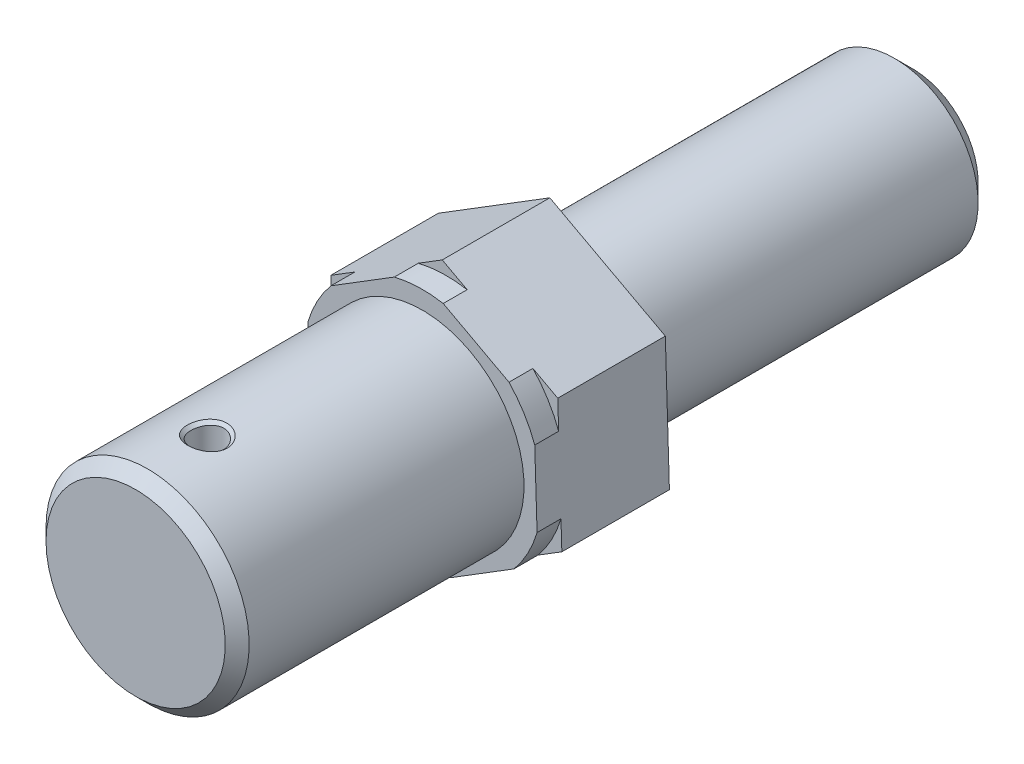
SolidWorks part; units mm, degrees
ref_plane "Face" through (0, 0, 0) normal (0, 0, 1) x (1, 0, 0)
ref_plane "Dessus" through (0, 0, 0) normal (0, 1, 0) x (1, 0, 0)
ref_plane "Droite" through (0, 0, 0) normal (1, 0, 0) x (0, 0, -1)
sketch "Esquisse1" plane through (0, 0, 0) normal (0, 0, 1) x (1, 0, 0)
  line L1 (9.666, -5.1866) -> (9.3248, 5.7777)
  line L2 (9.3248, 5.7777) -> (-0.3412, 10.9643)
  line L3 (-0.3412, 10.9643) -> (-9.666, 5.1866)
  line L4 (-9.666, 5.1866) -> (-9.3248, -5.7777)
  line L5 (-9.3248, -5.7777) -> (0.3412, -10.9643)
  line L6 (0.3412, -10.9643) -> (9.666, -5.1866)
  circle A0 centre (0, 0) radius 9.5 construction
  dimension "D1" = 19
extrude "Extrusion1" add sketch "Esquisse1" along normal blind 35
sketch "Esquisse2" plane through (0, 0, 0) normal (1, 0, 0) x (0, 0, -1)
  line L0 (1.4932, 0) -> (-36.0009, 0) construction
  line L1 (-9, 13.086) -> (-9, 10)
  line L2 (-9, 10) -> (-11, 10)
  line L3 (-11, 10) -> (-11, 8.5)
  line L4 (-11, 8.5) -> (-35.8368, 8.5)
  line L5 (-35.8368, 8.5) -> (-35.8368, 13.086)
  line L6 (-35.8368, 13.086) -> (-9, 13.086)
  dimension "D1" = 11
  dimension "D2" = 10
  dimension "D3" = 8.5
  dimension "D4" = 3.086
  dimension "D5" = 2
revolve "Enlèvement de matière-Révolution1" cut sketch "Esquisse2" angle 360 about L0
chamfer "Chanfrein1" distance 1 angle 45
sketch "Esquisse4" plane through (0, 0, 0) normal (0, 0, -1) x (-1, 0, 0)
  circle A0 centre (0, 0) radius 7
  dimension "D1" = 14
extrude "Extrusion2" add sketch "Esquisse4" along normal blind 30
chamfer "Chanfrein3" distance 1.5 angle 45
sketch "Esquisse5" plane through (0, 0, 0) normal (0, 1, 0) x (1, 0, 0)
  line L0 (-7.6579, -11) -> (-2.3493, -11) construction
  circle A0 centre (0, -29) radius 1.375
  dimension "D2" = 2.75
  dimension "D1" = 18
extrude "Enlèv. mat.-Extru.1" cut sketch "Esquisse5" against normal through all and the other way through all
chamfer "Chanfrein4" distance 0.25 angle 45
